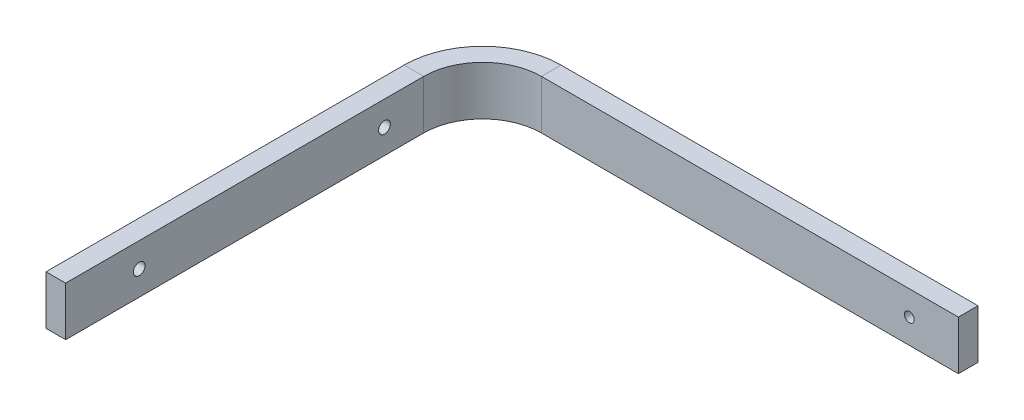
SolidWorks part; units mm, degrees
ref_plane "Plan de face" through (0, 0, 0) normal (0, 0, 1) x (1, 0, 0)
ref_plane "Plan de dessus" through (0, 0, 0) normal (0, 1, 0) x (1, 0, 0)
ref_plane "Plan de droite" through (0, 0, 0) normal (1, 0, 0) x (0, 0, -1)
sketch "Esquisse1" plane through (0, 0, 0) normal (0, 0, 1) x (1, 0, 0)
  line L1 (0, 12.5) -> (-450, 12.5)
  line L2 (0, 12.5) -> (0, -12.5)
  line L3 (0, -12.5) -> (-450, -12.5)
  line L4 (-450, 12.5) -> (-450, -12.5)
  dimension "D1" = 450
  dimension "D2" = 25
extrude "Extrusion1" add sketch "Esquisse1" along normal blind 10
sheet metal parameters "Tôlerie 1" parameters "D1"=30
flatten bends "Dépliage 1" parameters "D1"=0
sketch "Esquisse-Angle1" plane through (0, 0, 10) normal (0, 0, 1) x (1, 0, 0)
process bends "Pliage 1" parameters "D1"=0
sketch "Esquisse-Plate1" plane through (0, 0, 10) normal (0, 0, 1) x (1, 0, 0)
  line L0 (-240, 12.5) -> (-240, -12.5)
  line L1 (0, 12.5) -> (-450, 12.5) construction
  line L2 (-450, -12.5) -> (0, -12.5) construction
  line L3 (-450, 12.5) -> (-450, -12.5) construction
  point P8 (-235, 0)
  dimension "D1" = 210
bend "Pli défini à plat1" bend angle 90 parameters "D1"=0, "D5"=1
sketch "Esquisse5" plane through (-242.5111, 0, 0) normal (1, 0, 0) x (0, 0, -1)
  line L0 (0, -12.5) -> (0, 12.5) construction
  circle A0 centre (-185, 0) radius 3
  circle A1 centre (-60, 0) radius 3
  dimension "D1" = 6
  dimension "D2" = 125
  dimension "D3" = 60
extrude "Enlèv. mat.-Extru.1" cut sketch "Esquisse5" against normal through all
sketch "Esquisse7" plane through (0, 0, 10) normal (0, 0, 1) x (1, 0, 0)
  line L0 (0, -12.5) -> (0, 12.5) construction
  circle A0 centre (-25, 0) radius 2.5
  dimension "D1" = 5
  dimension "D2" = 25
extrude "Enlèv. mat.-Extru.2" cut sketch "Esquisse7" against normal through all
flat pattern "Etat déplié1"
sketch "Lignes de pliage1" plane through (0, 0, 0) normal (0, 1, 0) x (-1, 0, 0)
